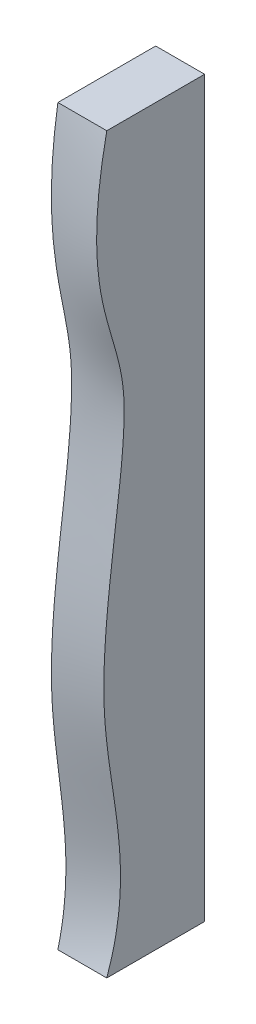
SolidWorks part; units mm, degrees
ref_plane "Ebene vorne" through (0, 0, 0) normal (0, 0, 1) x (1, 0, 0)
ref_plane "Ebene oben" through (0, 0, 0) normal (0, 1, 0) x (1, 0, 0)
ref_plane "Ebene rechts" through (0, 0, 0) normal (1, 0, 0) x (0, 0, -1)
body saved out of another part "Basisteil-Deckenbalken_Jan_SW2012-1"
